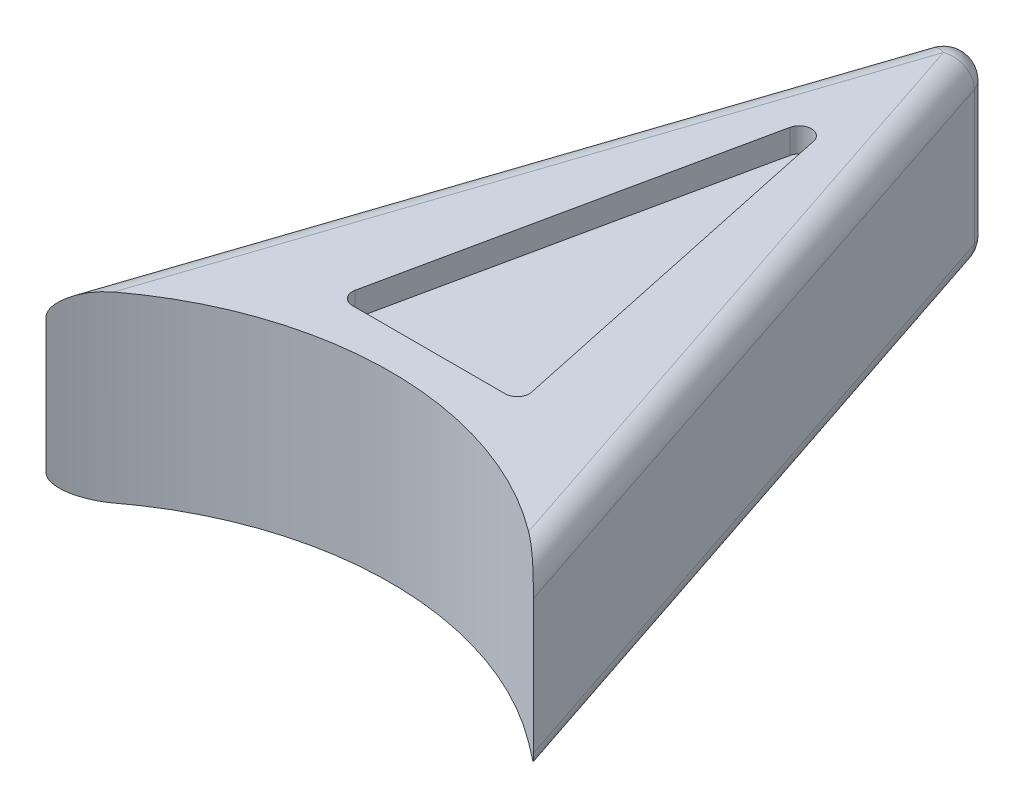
SolidWorks part; units mm, degrees
ref_plane "Front Plane" through (0, 0, 0) normal (0, 0, 1) x (1, 0, 0)
ref_plane "Top Plane" through (0, 0, 0) normal (0, 1, 0) x (1, 0, 0)
ref_plane "Right Plane" through (0, 0, 0) normal (1, 0, 0) x (0, 0, -1)
sketch "Sketch1" plane through (0, 0, 0) normal (0, 1, 0) x (1, 0, 0)
  line L0 (0, 0) -> (0, 76.2) construction
  line L1 (0, 76.2) -> (-25.4, 0)
  line L3 (25.4, 0) -> (0, 76.2)
  arc A0 (-25.4, 0) -> (25.4, 0) centre (0, -25.4) cw
  dimension "D1" = 50.8
  dimension "D2" = 76.2
extrude "Boss-Extrude1" add sketch "Sketch1" along normal blind 19.05
fillet "Fillet3" radius 2.54 1 edges at (0, 9.525, -76.2)
fillet "Fillet4" radius 2.54 6 edges at (0, 0, -70.7078) (0, 19.05, -70.7078) (-13.9048, 0, -34.4855) (13.9048, 0, -34.4855) (-13.9048, 19.05, -34.4855) (13.9048, 19.05, -34.4855)
sketch "Sketch2" plane through (0, 19.05, 0) normal (0, 1, 0) x (1, 0, 0)
  line L0 (0, 0) -> (0, 68.1678) construction
  line L1 (0, 59.2149) -> (-9.525, 14.4981)
  line L2 (-9.525, 14.4981) -> (9.525, 14.4981)
  line L3 (9.525, 14.4981) -> (0, 59.2149)
  dimension "D1" = 19.05
  dimension "D2" = 45.72
extrude "Cut-Extrude1" cut sketch "Sketch2" against normal blind 2.54
fillet "Fillet5" radius 1.27 3 edges at (0, 17.78, -59.2149) (9.525, 17.78, -14.4981) (-9.525, 17.78, -14.4981)
